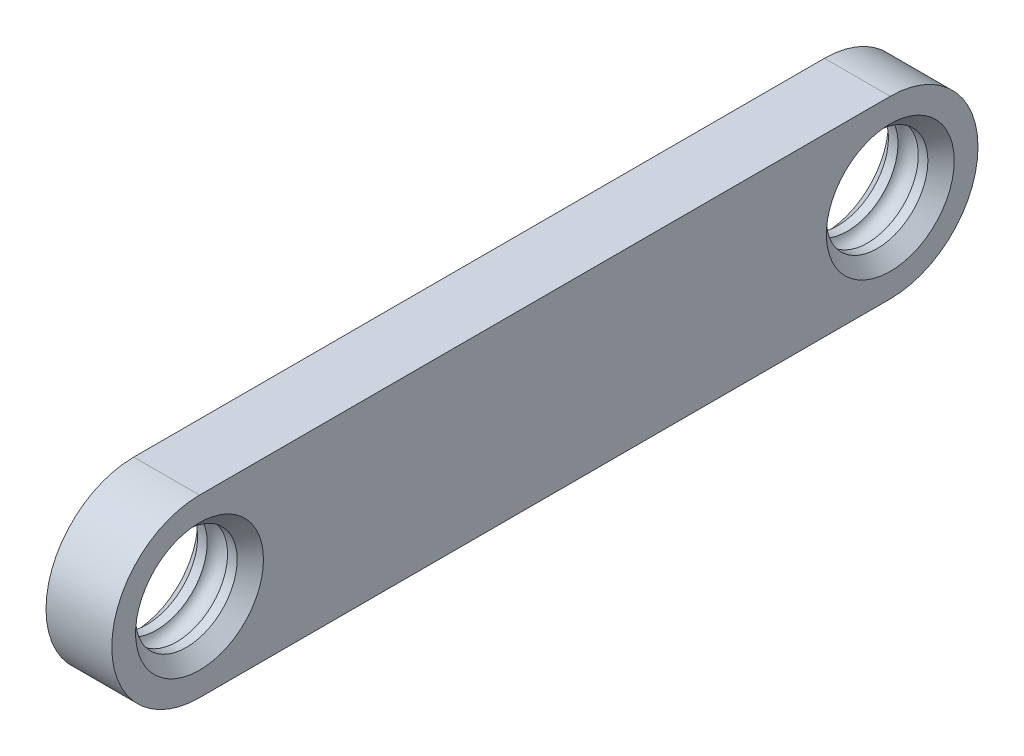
SolidWorks part; units mm, degrees
ref_plane "Front Plane" through (0, 0, 0) normal (0, 0, 1) x (1, 0, 0)
ref_plane "Top Plane" through (0, 0, 0) normal (0, 1, 0) x (1, 0, 0)
ref_plane "Right Plane" through (0, 0, 0) normal (1, 0, 0) x (0, 0, -1)
sketch "Sketch1" plane through (0, 0, 0) normal (1, 0, 0) x (0, 0, -1)
  line L0 (0, 0) -> (50, 0) construction
  line L1 (0, 6.35) -> (50, 6.35)
  line L2 (0, -6.35) -> (50, -6.35)
  arc A0 (0, 6.35) -> (0, -6.35) centre (0, 0) ccw
  arc A1 (50, -6.35) -> (50, 6.35) centre (50, 0) ccw
  circle A2 centre (0, 0) radius 3.175
  circle A3 centre (50, 0) radius 3.175
  circle A8 centre (0, 0) radius 3.675
  circle A9 centre (50, 0) radius 3.675
  point P3 (25, 0)
  dimension "D2" = 6.35
  dimension "D3" = 6.35
  dimension "D4" = 6.35
  dimension "D1" = 50
  dimension "D9" = 0.5
  dimension "D10" = 0.5
extrude "Boss-Extrude1" add sketch "Sketch1" along normal blind 4.7625
chamfer "Chamfer1" distance 0.9525 angle 45 4 edges at (4.7625, 0, -3.675) (0, 0, -3.675) (4.7625, 0, -53.675) (0, 0, -53.675)
sketch "Sketch2" plane through (0, 0, 0) normal (0, 1, 0) x (1, 0, 0)
  line L0 (3.81, 3.675) -> (3.81, -3.675) construction
  line L1 (0.4525, -3.675) -> (5.2078, -3.675) construction
  line L2 (0.4525, 3.675) -> (0.4525, -3.675)
  line L3 (0.4525, 3.675) -> (0.4525, -3.675) construction
  line L4 (3.81, 3.675) -> (3.81, -3.675) construction
  line L5 (4.7625, -6.35) -> (4.7625, 0) construction
  line L6 (0.4525, 0) -> (3.81, 0)
  circle A0 centre (2.3813, -3.375) radius 0.7938
  dimension "D2" = 1.5875
  dimension "D4" = 2.3813
  dimension "D3" = 0.3
  dimension "D1" = 0.5
revolve "Cut-Revolve1" cut sketch "Sketch2" angle 360 about L6
sketch "Sketch3" plane through (0, 0, 0) normal (-1, 0, 0) x (0, 0, 1)
  circle A0 centre (-50, 0) radius 3.675 construction
  circle A5 centre (-50, 0) radius 3.675 construction
  point P16 (-50, 0)
pattern_sketch "Sketch-Pattern2" of "Cut-Revolve1"
sketch "Sketch4" plane through (0, 0, 0) normal (-1, 0, 0) x (0, 0, 1)
  point P1 (0, 0)
